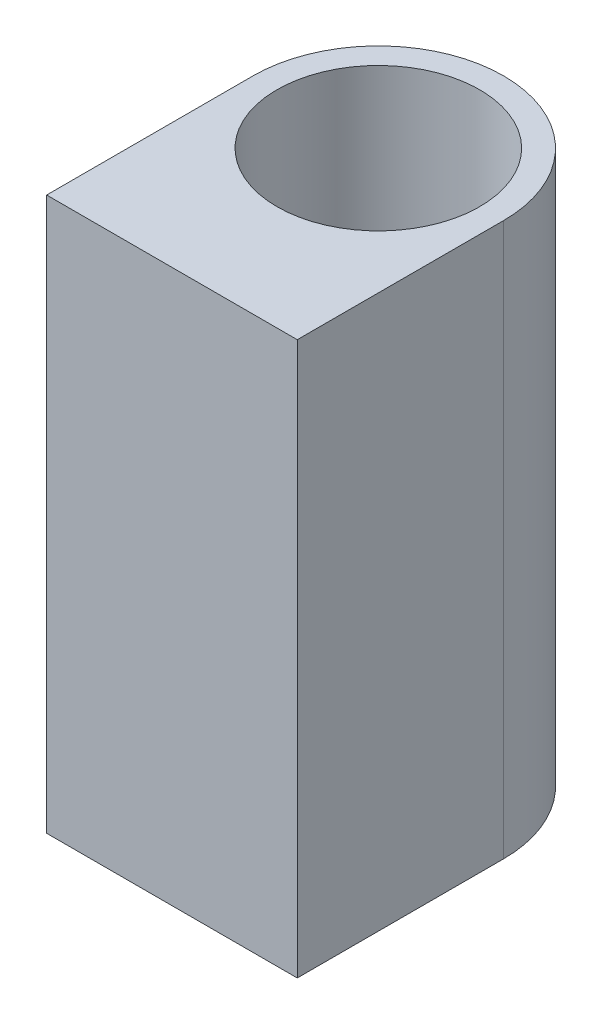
SolidWorks part; units mm, degrees
ref_plane "Alzado" through (0, 0, 0) normal (0, 0, 1) x (1, 0, 0)
ref_plane "Planta" through (0, 0, 0) normal (0, 1, 0) x (1, 0, 0)
ref_plane "Vista lateral" through (0, 0, 0) normal (1, 0, 0) x (0, 0, -1)
sketch "Croquis1" plane through (0, 0, 0) normal (0, 1, 0) x (1, 0, 0)
  line L0 (34, 0) -> (-34, 0)
  line L1 (0, 0) -> (0, 90) construction
  line L2 (-34, 0) -> (-34, 56)
  line L4 (34, 56) -> (34, 0)
  arc A0 (34, 56) -> (-34, 56) centre (0, 56) ccw
  point P4 (0, 0)
  dimension "D1" = 56
  dimension "D2" = 68
extrude "Saliente-Extruir1" add sketch "Croquis1" along normal blind 150
sketch "Croquis2" plane through (0, 150, 0) normal (0, 1, 0) x (1, 0, 0)
  circle A0 centre (0, 56) radius 27.5
  dimension "D1" = 55
extrude "Cortar-Extruir1" cut sketch "Croquis2" against normal blind 70 contours A0
sketch "Croquis3" plane through (0, 0, 0) normal (0, -1, 0) x (1, 0, 0)
  circle A0 centre (0, -56) radius 27.5
  dimension "D1" = 55
extrude "Cortar-Extruir2" cut sketch "Croquis3" against normal blind 70
